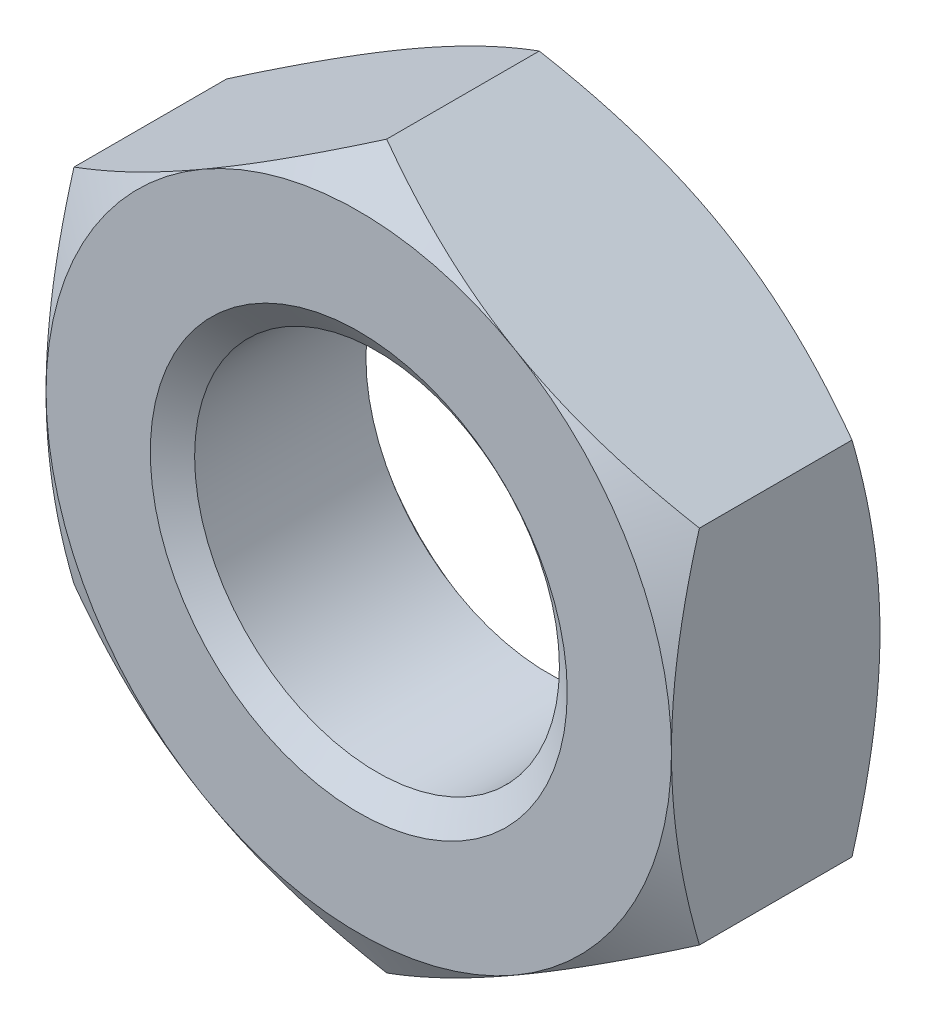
SolidWorks part; units mm, degrees
ref_plane "Plane1" through (0, 0, 0) normal (0, 0, 1) x (1, 0, 0)
ref_plane "Plane2" through (0, 0, 0) normal (0, 1, 0) x (1, 0, 0)
ref_plane "Plane3" through (0, 0, 0) normal (1, 0, 0) x (0, 0, -1)
revolve "EndChamfer" cut sketch "Sketch5"
sketch "Sketch5"
  line L0 (7.9746, 8) -> (7.2044, 6.9)
  line L1 (8.0254, 8) -> (7.9746, 8)
  line L2 (8.0254, 8) -> (8.0254, 6.9)
  line L3 (8.0254, 6.9) -> (7.2044, 6.9)
  line L6 (-0.0508, 8) -> (0, 8)
  line L7 (0, 8) -> (0.7702, 6.9)
  line L9 (0.7702, 6.9) -> (-0.0508, 6.9)
  line L10 (-0.0508, 6.9) -> (-0.0508, 8)
  line L11 (25.0375, 0) -> (38.388, 0) construction
  line L12 (8, 0) -> (0, 0) construction
extrude "BaseNut" add sketch "BaseNutSke" against normal blind 8
sketch "BaseNutSke" plane through (0, 0, 0) normal (0, 0, 1) x (1, 0, 0)
  line L6 (12, 6.9282) -> (12, -6.9282)
  line L7 (-12, 6.9282) -> (-12, -6.9282)
  line L8 (12, 6.9282) -> (0, 13.8564)
  line L9 (0, 13.8564) -> (-12, 6.9282)
  line L10 (-12, -6.9282) -> (0, -13.8564)
  line L11 (0, -13.8564) -> (12, -6.9282)
  circle A0 centre (0, 0) radius 7
  dimension "D4" = 12
  dimension "Tap_drill" = 14
  dimension "D1" = 120
  dimension "D2" = 12
  dimension "D3" = 12
  dimension "Width_flats" = 24
pattern_linear "ThdSchPat" [suppressed]
revolve "ThreadSchematic" cut sketch "ThdSchSke" angle 360 about L11
sketch "ThdSchSke" plane through (0, 0, 0) normal (0, 1, 0) x (1, 0, 0)
  line L0 (-8, 0.0254) -> (-7, 0.7256)
  line L1 (-7, 0.7256) -> (-3.5, 0.7256)
  line L2 (-3.5, 0.7256) -> (-3.5, -0.6748)
  line L3 (-3.5, -0.6748) -> (-7, -0.6748)
  line L4 (-7, -0.6748) -> (-8, 0.0254)
  line L5 (-3.175, 2) -> (3.175, 2) construction
  line L6 (0, 2) -> (0, -2.9874) construction
  line L7 (0, 7.2744) -> (0, 0.7002) construction
  dimension "D1" = 35
  dimension "VeeAngle" = 70
  dimension "SideAngle" = 55
  dimension "D2" = 0.0508
  dimension "OverCut" = 7
  dimension "Tap_Drill" = 14
  dimension "Advance" = 1.9873
  dimension "Thread_major" = 16
  dimension "Num_threads" = 5
  dimension "D4" = 50
  dimension "Offset1" = 8.0254
  dimension "ThreadMajor" = 8
  dimension "ChamferDepth" = 1.1
  dimension "Offset2" = 8.0762
sketch "Sketch4" plane through (0, 0, 0) normal (1, 0, 0) x (0, 0, -1)
  line L0 (8, 12) -> (7.99, 12)
  line L1 (8, 12) -> (8, 23.8564)
  line L2 (7.99, 23.8564) -> (8, 23.8564)
  line L3 (7.99, 23.8564) -> (7.99, 12)
  line L4 (0, 0) -> (34.925, 0) construction
  line L6 (8, 6.9282) -> (8, 13.8564) construction
  line L7 (0, 12) -> (-10, 12)
  line L8 (0, 6.9282) -> (0, 13.8564) construction
  line L9 (1.0718, 13.8564) -> (1.0718, 23.8564)
  line L10 (1.0718, 23.8564) -> (-10, 23.8564)
  line L11 (-10, 23.8564) -> (-10, 12)
  line L12 (0, 12) -> (1.0718, 13.8564)
  line L14 (0, 6.9282) -> (0, -6.9282) construction
  line L15 (8, 13.8564) -> (0, 13.8564) construction
  dimension "D1" = 12
  dimension "D2" = 30
  dimension "Bearing_ht" = 0.01
  dimension "D3" = 10
  dimension "D4" = 10
revolve "Bearing-Face" [suppressed] cut sketch "Sketch4" angle 360 about L4
sketch "Sketch3" plane through (0, 0, 0) normal (1, 0, 0) x (0, 0, -1)
  line L0 (8, 12) -> (6.9282, 13.8564)
  line L1 (6.9282, 13.8564) -> (6.9282, 23.8564)
  line L2 (6.9282, 23.8564) -> (18, 23.8564)
  line L3 (18, 23.8564) -> (18, 12)
  line L4 (18, 12) -> (8, 12)
  line L5 (8, 6.9282) -> (8, 13.8564) construction
  line L6 (8, 13.8564) -> (0, 13.8564) construction
  line L7 (0, 0) -> (38.6776, 0) construction
  line L8 (8, 0) -> (0, 0) construction
  line L9 (4, 13.8564) -> (4, 44.222) construction
  line L10 (1.0718, 23.8564) -> (-10, 23.8564)
  line L11 (-10, 23.8564) -> (-10, 12)
  line L12 (-10, 12) -> (0, 12)
  line L13 (0, 12) -> (1.0718, 13.8564)
  line L14 (1.0718, 13.8564) -> (1.0718, 23.8564)
  line L16 (8, 13.8564) -> (0, 13.8564) construction
  dimension "D1" = 12
  dimension "D2" = 30
  dimension "D3" = 10
  dimension "D4" = 10
revolve "Double-Chamfer" cut sketch "Sketch3" angle 360 about L7
equation "\"D2@BaseNutSke\" = \"Width_flats@BaseNutSke\" / 2"
equation "\"D3@BaseNutSke\" = \"Width_flats@BaseNutSke\" / 2"
equation "\"D1@Sketch3\" = \"Width_flats@BaseNutSke\" /2"
equation "\"D1@Sketch4\" = \"D2@BaseNutSke\""
equation "\"D4@BaseNutSke\" = \"D3@BaseNutSke\""
equation "\"Thread_major@ThdSchSke\" = \"Thread_major@ThreadCosmetic\""
equation "\"Tap_drill@ThdSchSke\" = \"Tap_drill@BaseNutSke\""
equation "\"Overcut@ThdSchSke\" = \"Tap_drill@ThdSchSke\" * 0.5"
equation "\"Num_threads@ThdSchPat\" = int(  ( \"Thickness@BaseNut\" - 0.0508 ) / \"Advance@ThdSchSke\" + 0.999 )  + 1"
equation "\"Advance@ThdSchPat\" = ( \"Thickness@BaseNut\" - 0.0508 ) /  (\"Num_threads@ThdSchPat\" - 1) 'relax it"
equation "' \"Num_threads@ThdSchPat\" = \"Num_threads@ThdSchPat\" - sgn( \"Num_threads@ThdSchPat\" - 1) '---chamfered tips only---"
equation "\"ThreadMajor@Sketch5\" = \"Thread_major@ThreadCosmetic\" * 0.5"
equation "\"ChamferDepth@Sketch5\" = (\"Thread_major@ThreadCosmetic\" - \"Tap_drill@BaseNutSke\") * 0.55"
equation "\"Offset1@Sketch5\" = \"Thickness@BaseNut\" + 0.0254"
equation "\"Offset2@Sketch5\" = \"Offset1@Sketch5\" + 0.0508"
